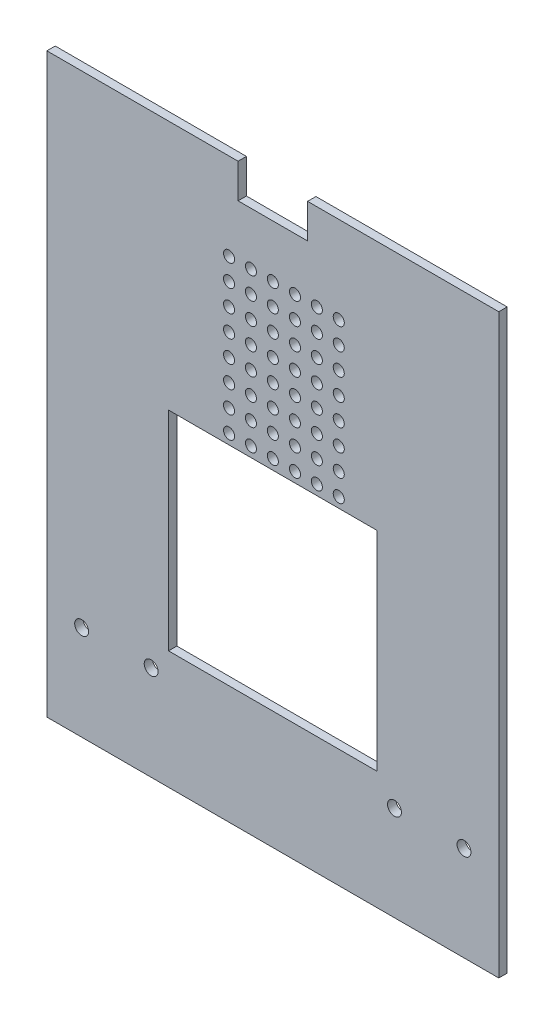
SolidWorks part; units mm, degrees
ref_plane "Front Plane" through (0, 0, 0) normal (0, 0, 1) x (1, 0, 0)
ref_plane "Top Plane" through (0, 0, 0) normal (0, 1, 0) x (1, 0, 0)
ref_plane "Right Plane" through (0, 0, 0) normal (1, 0, 0) x (0, 0, -1)
sketch "Sketch1" plane through (0, 0, 0) normal (0, 0, 1) x (1, 0, 0)
  line L1 (-82.55, 146.05) -> (82.55, 146.05)
  line L2 (-82.55, 146.05) -> (-82.55, -146.05)
  line L3 (-82.55, -146.05) -> (82.55, -146.05)
  line L4 (82.55, 146.05) -> (82.55, -146.05)
  line L5 (-82.55, 146.05) -> (82.55, -146.05) construction
  line L6 (-82.55, -146.05) -> (82.55, 146.05) construction
  point P0 (0, 0)
  dimension "D1" = 165.1
  dimension "D2" = 292.1
extrude "Boss-Extrude1" add sketch "Sketch1" along normal blind 3.048
sketch "Sketch2" plane through (0, 0, 0) normal (0, 0, 1) x (1, 0, 0)
  line L1 (-82.55, -146.05) -> (82.55, -146.05) construction
  line L2 (-82.55, -146.05) -> (82.55, -146.05) construction
  line L3 (8.0869, 109.0549) -> (-8.0869, 109.0549)
  line L4 (8.0869, 109.0549) -> (8.0869, 76.3651)
  line L5 (8.0869, 76.3651) -> (-8.0869, 76.3651)
  line L6 (-8.0869, 109.0549) -> (-8.0869, 76.3651)
  line L7 (8.0869, 109.0549) -> (-8.0869, 76.3651) construction
  line L8 (8.0869, 76.3651) -> (-8.0869, 109.0549) construction
  line L9 (-38.1, -21.59) -> (38.1, -21.59)
  line L10 (-38.1, -21.59) -> (-38.1, -97.79)
  line L11 (-38.1, -97.79) -> (38.1, -97.79)
  line L12 (38.1, -21.59) -> (38.1, -97.79)
  line L13 (-38.1, -21.59) -> (38.1, -97.79) construction
  line L14 (-38.1, -97.79) -> (38.1, -21.59) construction
  circle A1 centre (0, 92.71) radius 10.7315
  circle A2 centre (0, 38.1) radius 2.0193
  circle A3 centre (0, 30.1) radius 2.0193
  circle A4 centre (0, 22.1) radius 2.0193
  circle A5 centre (0, 14.1) radius 2.0193
  circle A6 centre (0, 6.1) radius 2.0193
  circle A7 centre (0, -1.9) radius 2.0193
  circle A8 centre (0, -9.9) radius 2.0193
  circle A9 centre (0, -17.9) radius 2.0193
  circle A10 centre (-8, 38.1) radius 2.0193
  circle A11 centre (-16, 38.1) radius 2.0193
  circle A12 centre (-8, 30.1) radius 2.0193
  circle A13 centre (-16, 30.1) radius 2.0193
  circle A14 centre (-8, 22.1) radius 2.0193
  circle A15 centre (-16, 22.1) radius 2.0193
  circle A16 centre (-8, 14.1) radius 2.0193
  circle A17 centre (-16, 14.1) radius 2.0193
  circle A18 centre (-8, 6.1) radius 2.0193
  circle A19 centre (-16, 6.1) radius 2.0193
  circle A20 centre (-8, -1.9) radius 2.0193
  circle A21 centre (-16, -1.9) radius 2.0193
  circle A22 centre (-8, -9.9) radius 2.0193
  circle A23 centre (-16, -9.9) radius 2.0193
  circle A24 centre (-8, -17.9) radius 2.0193
  circle A25 centre (-16, -17.9) radius 2.0193
  circle A26 centre (24.0869, 14.1) radius 2.0193
  circle A27 centre (8.0869, 14.1) radius 2.0193
  circle A28 centre (8.0869, -17.9) radius 2.0193
  circle A29 centre (24.0869, 6.1) radius 2.0193
  circle A30 centre (16.0869, 6.1) radius 2.0193
  circle A31 centre (8.0869, -1.9) radius 2.0193
  circle A32 centre (8.0869, 30.1) radius 2.0193
  circle A33 centre (24.0869, 22.1) radius 2.0193
  circle A34 centre (24.0869, -1.9) radius 2.0193
  circle A35 centre (24.0869, -9.9) radius 2.0193
  circle A36 centre (8.0869, 6.1) radius 2.0193
  circle A37 centre (16.0869, 22.1) radius 2.0193
  circle A38 centre (8.0869, 22.1) radius 2.0193
  circle A39 centre (8.0869, -9.9) radius 2.0193
  circle A40 centre (24.0869, -17.9) radius 2.0193
  circle A41 centre (16.0869, 14.1) radius 2.0193
  circle A42 centre (16.0869, -17.9) radius 2.0193
  circle A43 centre (16.0869, 30.1) radius 2.0193
  circle A44 centre (24.0869, 30.1) radius 2.0193
  circle A45 centre (16.0869, -9.9) radius 2.0193
  circle A46 centre (16.0869, -1.9) radius 2.0193
  circle A47 centre (16.0869, 38.1) radius 2.0193
  circle A48 centre (8.0869, 38.1) radius 2.0193
  circle A49 centre (24.0869, 38.1) radius 2.0193
  point P2 (0, -59.69)
  dimension "D3" = 21.463
  dimension "D5" = 4.0386
  dimension "D7" = 184.15
  dimension "D2" = 86.36
  dimension "D4" = 152.4
  dimension "D8" = 16.1738
  dimension "D9" = 32.6898
  dimension "D11" = 76.2
  dimension "D12" = 76.2
  dimension "D6" = 3
  dimension "D10" = 8
extrude "Cut-Extrude1" cut sketch "Sketch2" along normal through all contours A13 | A19 | A18 | A20 | A24 | A39 | A31
sketch "Sketch4" plane through (0, 0, 0) normal (0, 0, 1) x (1, 0, 0)
  line L0 (-12.7, 57.3108) -> (-12.7, 69.85)
  line L1 (82.55, 146.05) -> (-82.55, 146.05)
  line L2 (82.55, 146.05) -> (82.55, 69.85)
  line L4 (-82.55, 146.05) -> (-82.55, 69.85)
  line L7 (-12.7, 57.3108) -> (12.7, 57.3108)
  line L9 (12.7, 57.3108) -> (12.7, 69.85)
  line L10 (-82.55, 69.85) -> (-12.7, 69.85)
  line L11 (12.7, 69.85) -> (82.55, 69.85)
  point P5 (0, 146.05)
  dimension "D1" = 165.1
  dimension "D2" = 76.2
  dimension "D3" = 25.4
  dimension "D4" = 69.85
extrude "Cut-Extrude2" cut sketch "Sketch4" along normal through all
sketch "Sketch5" plane through (0, 0, 0) normal (0, 0, -1) x (-1, 0, 0)
  line L0 (82.55, -146.05) -> (-82.55, -146.05) construction
  line L1 (-82.55, -146.05) -> (-82.55, 69.85) construction
  line L2 (0, 1.6764) -> (0, -1.6764) construction
  circle A0 centre (-44.45, -106.299) radius 2.54
  circle A2 centre (-69.85, -106.299) radius 2.54
  circle A3 centre (69.85, -106.299) radius 2.54
  circle A4 centre (44.45, -106.299) radius 2.54
  dimension "D1" = 5.08
  dimension "D2" = 39.751
  dimension "D3" = 25.4
  dimension "D4" = 12.7
extrude "Cut-Extrude3" cut sketch "Sketch5" against normal through all
sketch "Sketch6" plane through (0, 0, 0) normal (0, 0, -1) x (-1, 0, 0)
  line L0 (82.55, 69.85) -> (82.55, -146.05) construction
  line L1 (-82.55, -146.05) -> (82.55, -146.05)
  line L2 (-82.55, -146.05) -> (-82.55, -140.97)
  line L3 (-82.55, -140.97) -> (82.55, -140.97)
  line L4 (82.55, -146.05) -> (82.55, -140.97)
  dimension "D1" = 5.08
extrude "Cut-Extrude4" cut sketch "Sketch6" against normal through all
equation "\"thickness_acrylic0.1\"=0.1in"
equation "\"motor offset\"=6mm"
equation "\"thickness0.25\"=0.225in"
equation "\"thickness0.125\"=0.122in"
